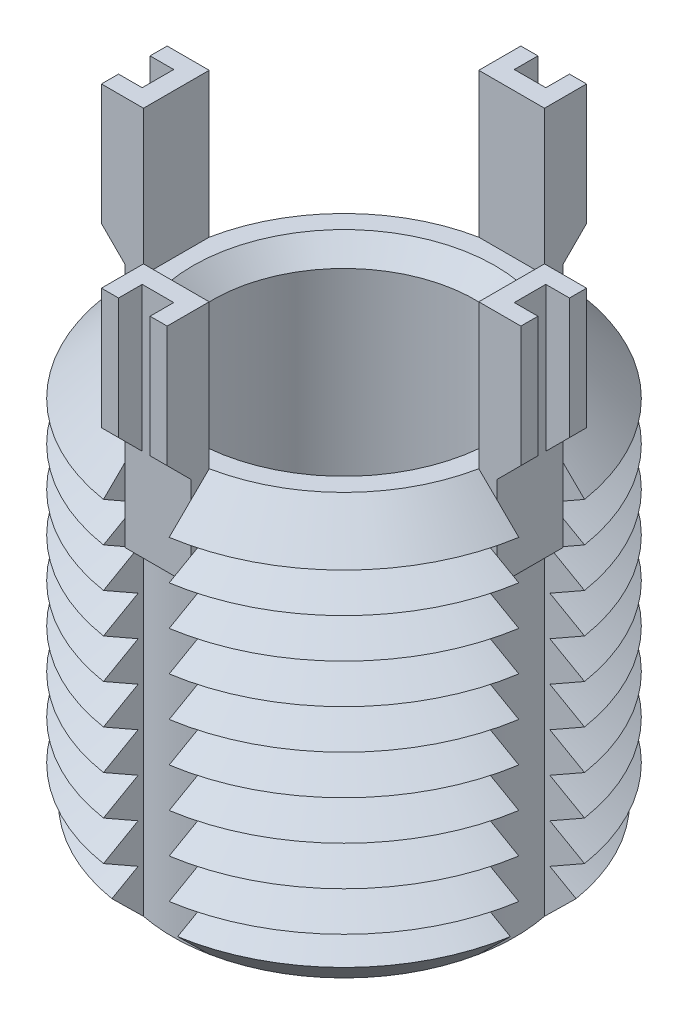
SolidWorks part; units mm, degrees
ref_plane "Front Plane" through (0, 0, 0) normal (0, 0, 1) x (1, 0, 0)
ref_plane "Top Plane" through (0, 0, 0) normal (0, 1, 0) x (1, 0, 0)
ref_plane "Right Plane" through (0, 0, 0) normal (1, 0, 0) x (0, 0, -1)
sketch "Sketch1" plane through (0, 0, 0) normal (0, 1, 0) x (1, 0, 0)
  circle A0 centre (0, 0) radius 8
  dimension "D1" = 16
extrude "Boss-Extrude1" add sketch "Sketch1" against normal blind 16
chamfer "Chamfer1" distance 1.5 angle 45 2 edges at (0, -16, 8) (0, 0, 8)
sketch "Sketch2" plane through (0, 0, 0) normal (1, 0, 0) x (0, 0, -1)
  line L0 (0, 0.8859) -> (0, -9.2617) construction
sketch "Sketch3" plane through (0, 0, 0) normal (1, 0, 0) x (0, 0, -1)
  line L0 (-8, -1.5) -> (-6.701, -2.25)
  line L1 (-6.701, -2.25) -> (-8, -3)
  line L2 (-8, -1.5) -> (-8, -14.5) construction
  line L3 (-8, -3) -> (-8, -1.5)
  dimension "D1" = 1.5
revolve "Cut-Revolve1" cut sketch "Sketch3" angle 360 about L0
pattern_linear "LPattern1" count 9 spacing 1.5 along (0, -1, 0) of "Cut-Revolve1"
sketch "Sketch4" plane through (0, 0, 0) normal (0, 1, 0) x (1, 0, 0)
  line L0 (-6.3787, 1.25) -> (-7.9017, 1.25)
  line L2 (-7.9017, -1.25) -> (-6.3787, -1.25)
  arc A0 (-6.3787, 1.25) -> (-6.3787, -1.25) centre (0, 0) ccw
  arc A1 (-7.9017, 1.25) -> (-7.9017, -1.25) centre (0, 0) ccw
  circle A2 centre (0, 0) radius 8 construction
  circle A3 centre (0, 0) radius 6.5 construction
  point P1 (-6.5, 0)
  point P3 (-8, 0)
  point P13 (0, 0)
  dimension "D1" = 2.5
extrude "Cut-Extrude1" cut sketch "Sketch4" against normal up to surface (16 mm away)
pattern_circular "CirPattern1" count 4 over 360 about axis through (0, 0, 0) along (0, 1, 0) of "Cut-Extrude1"
sketch "Sketch5" plane through (0, 0, 0) normal (1, 0, 0) x (0, 0, -1)
  line L0 (-6.3787, 5.5) -> (-6.3787, -3.5)
  line L1 (-6.3787, -3.5) -> (-7.0787, -3.5)
  line L2 (-7.0787, -3.5) -> (-7.0787, 0)
  line L3 (-7.0787, 0) -> (-7.9787, 0.9)
  line L4 (-7.9787, 0.9) -> (-7.9787, 5.5)
  line L5 (-7.9787, 5.5) -> (-6.3787, 5.5)
  line L6 (-7.9017, -4.5) -> (-1.25, -4.5) construction
  point P9 (-1.25, 0)
  point P10 (-7.0787, 0)
  dimension "D1" = 1
  dimension "D2" = 9
  dimension "D3" = 5.5
  dimension "D4" = 1.6
  dimension "D5" = 0.7
  dimension "D6" = 45
extrude "Boss-Extrude3" add sketch "Sketch5" along normal mid plane 2.5
pattern_circular "CirPattern2" count 4 over 360 about axis through (0, 0, 0) along (0, 1, 0) of "Boss-Extrude3"
sketch "Sketch6" plane through (0, 5.5, 0) normal (0, 1, 0) x (1, 0, 0)
  line L0 (-7.9787, -1.25) -> (-7.9787, 1.25) construction
  line L1 (-7.9787, -0.6) -> (-7.0787, -0.6)
  line L2 (-7.9787, -0.6) -> (-7.9787, 0.6)
  line L3 (-7.9787, 0.6) -> (-7.0787, 0.6)
  line L4 (-7.0787, -0.6) -> (-7.0787, 0.6)
  line L5 (-7.9787, -0.6) -> (-7.0787, 0.6) construction
  line L6 (-7.9787, 0.6) -> (-7.0787, -0.6) construction
  line L7 (7.9787, 1.25) -> (7.9787, -1.25) construction
  line L8 (-0.6, 7.0787) -> (0.6, 7.0787)
  line L9 (-0.6, 7.0787) -> (-0.6, 7.9787)
  line L10 (-0.6, 7.9787) -> (0.6, 7.9787)
  line L11 (0.6, 7.0787) -> (0.6, 7.9787)
  line L12 (-0.6, 7.0787) -> (0.6, 7.9787) construction
  line L13 (-0.6, 7.9787) -> (0.6, 7.0787) construction
  line L14 (7.0787, -0.6) -> (7.9787, -0.6)
  line L15 (7.0787, -0.6) -> (7.0787, 0.6)
  line L16 (7.0787, 0.6) -> (7.9787, 0.6)
  line L17 (7.9787, -0.6) -> (7.9787, 0.6)
  line L18 (7.0787, -0.6) -> (7.9787, 0.6) construction
  line L19 (7.0787, 0.6) -> (7.9787, -0.6) construction
  line L20 (-0.6, -7.9787) -> (0.6, -7.9787)
  line L21 (-0.6, -7.9787) -> (-0.6, -7.0787)
  line L22 (-0.6, -7.0787) -> (0.6, -7.0787)
  line L23 (0.6, -7.9787) -> (0.6, -7.0787)
  line L24 (-0.6, -7.9787) -> (0.6, -7.0787) construction
  line L25 (-0.6, -7.0787) -> (0.6, -7.9787) construction
  line L26 (-1.25, 7.9787) -> (1.25, 7.9787) construction
  line L27 (1.25, -7.9787) -> (-1.25, -7.9787) construction
  point P0 (-7.5287, 0)
  point P7 (-7.9787, 0)
  point P8 (-7.9787, 0)
  point P9 (0, 7.5287)
  point P14 (7.5287, 0)
  point P19 (0, -7.5287)
  point P24 (0, 7.9787)
  point P25 (7.9787, 0)
  point P26 (7.9787, 0)
  point P27 (0, 7.9787)
  point P30 (0, -7.9787)
  point P33 (0, -7.9787)
  dimension "D1" = 1.2
  dimension "D2" = 0.9
extrude "Cut-Extrude3" cut sketch "Sketch6" against normal through all both and the other way through all
sketch "Sketch7" plane through (0, 0, 0) normal (0, 1, 0) x (1, 0, 0)
  circle A0 centre (0, 0) radius 5
  dimension "D1" = 10
extrude "Cut-Extrude4" cut sketch "Sketch7" against normal up to surface (16 mm away)
chamfer "Chamfer2" distance 0.75 angle 45 2 edges at (0, 0, 5) (0, -16, 5)
